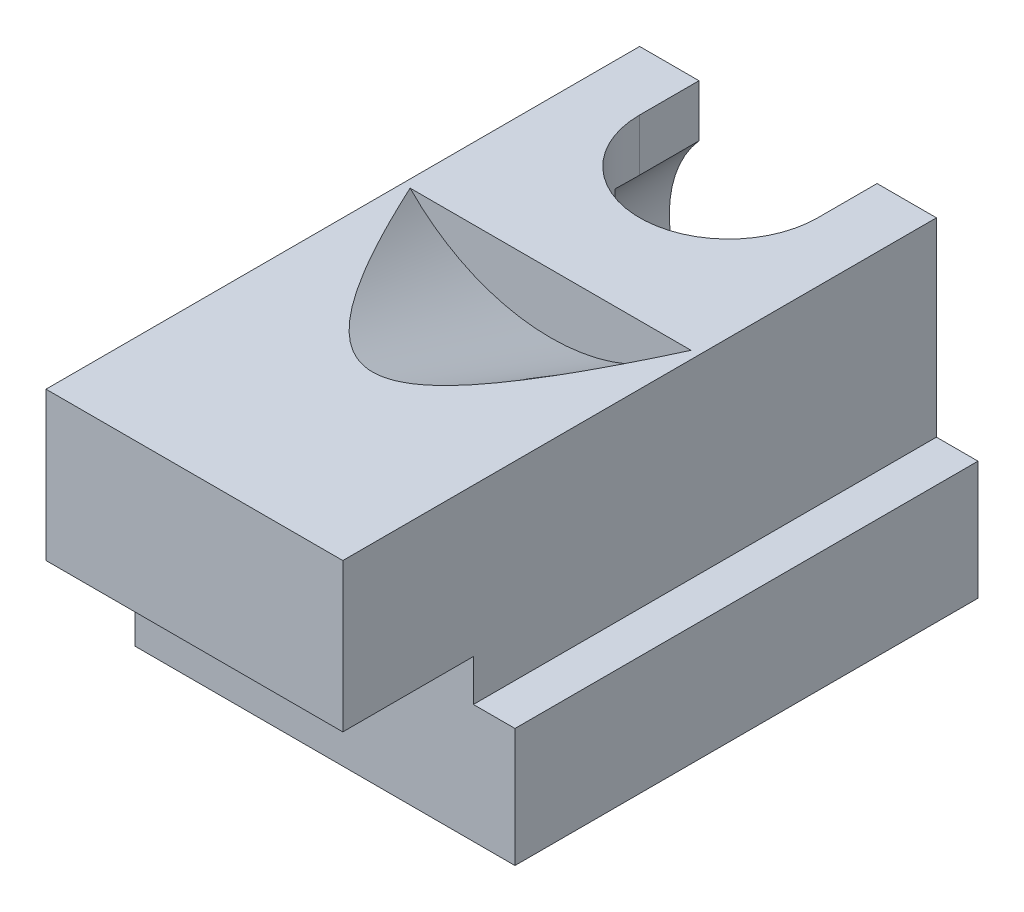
SolidWorks part; units mm, degrees
ref_plane "Přední rovina" through (0, 0, 0) normal (0, 0, 1) x (1, 0, 0)
ref_plane "Horní rovina" through (0, 0, 0) normal (0, 1, 0) x (1, 0, 0)
ref_plane "Pravá rovina" through (0, 0, 0) normal (1, 0, 0) x (0, 0, -1)
sketch "Skica1" plane through (0, 0, 0) normal (0, 0, 1) x (1, 0, 0)
  line L0 (3.2, 0) -> (-3.2, 0)
  line L1 (-3.2, 0) -> (-3.2, 2)
  line L2 (-3.2, 2) -> (-2.5, 2)
  line L3 (2.5, 2) -> (2.5, 5.2)
  line L4 (2.5, 5.2) -> (-2.5, 5.2)
  line L5 (0, 5.2) -> (0, 0) construction
  line L6 (-2.5, 2) -> (-2.5, 5.2)
  line L7 (3.2, 2) -> (2.5, 2)
  line L8 (3.2, 0) -> (3.2, 2)
  dimension "D1" = 6.4
  dimension "D2" = 5
  dimension "D3" = 5.2
  dimension "D4" = 2
extrude "Přidat vysunutím1" add sketch "Skica1" along normal blind 10
sketch "Skica2" plane through (3.2, 0, 0) normal (1, 0, 0) x (0, 0, -1)
  line L1 (-10, 0) -> (-7.8, 0)
  line L2 (-10, 0) -> (-10, 2.7)
  line L3 (-10, 2.7) -> (-7.8, 2.7)
  line L4 (-7.8, 0) -> (-7.8, 2.7)
  dimension "D1" = 2.7
  dimension "D2" = 2.2
extrude "Odebrat vysunutím1" cut sketch "Skica2" against normal through all
sketch "Skica3" plane through (0, 0, 0) normal (0, 0, -1) x (-1, 0, 0)
  line L0 (0, 0) -> (0, 3) construction
  line L1 (3.2, 0) -> (-3.2, 0) construction
  circle A0 centre (0, 3) radius 2
  dimension "D1" = 4
  dimension "D2" = 3
extrude "Odebrat vysunutím2" cut sketch "Skica3" against normal blind 1.5
sketch "Skica4" plane through (0, 5.2, 0) normal (0, 1, 0) x (1, 0, 0)
  line L0 (-1.5, -1) -> (-1.5, 0)
  line L1 (2.5, 0) -> (-2.5, 0) construction
  line L2 (-1.5, 0) -> (1.5, 0)
  line L3 (1.5, 0) -> (1.5, -1)
  line L4 (0, 0) -> (0, -1) construction
  arc A0 (-1.5, -1) -> (1.5, -1) centre (0, -1) ccw
  dimension "D1" = 3
  dimension "D2" = 1
extrude "Odebrat vysunutím3" cut sketch "Skica4" against normal blind 2
sketch "Skica5" plane through (0, 0, 1.5) normal (0, 0, -1) x (-1, 0, 0)
  circle A0 centre (0, 3) radius 0.7
  dimension "D1" = 1.4
extrude "Odebrat vysunutím4" cut sketch "Skica5" against normal blind 0.4
fillet "Zaoblit1" radius 0.75 1 edges at (0, 2.3, 1.9)
sketch "Skica6" plane through (0, 0, 0) normal (1, 0, 0) x (0, 0, -1)
  line L0 (-4, 5.2) -> (-4, 4.2)
  line L2 (-4, 4.2) -> (-7, 5.2)
  line L3 (-7, 5.2) -> (-7, 7.5)
  line L4 (0, 2) -> (0, 5.2) construction
  line L5 (-10, 5.2) -> (0, 5.2) construction
  line L6 (-7, 7.5) -> (-4, 7.5)
  line L7 (-4, 7.5) -> (-4, 5.2)
  dimension "D1" = 4
  dimension "D2" = 7
  dimension "D3" = 1
  dimension "D4" = 2.3
  dimension "D5" = 1
revolve "Odebrat rotací1" cut sketch "Skica6" angle 360 about L6
